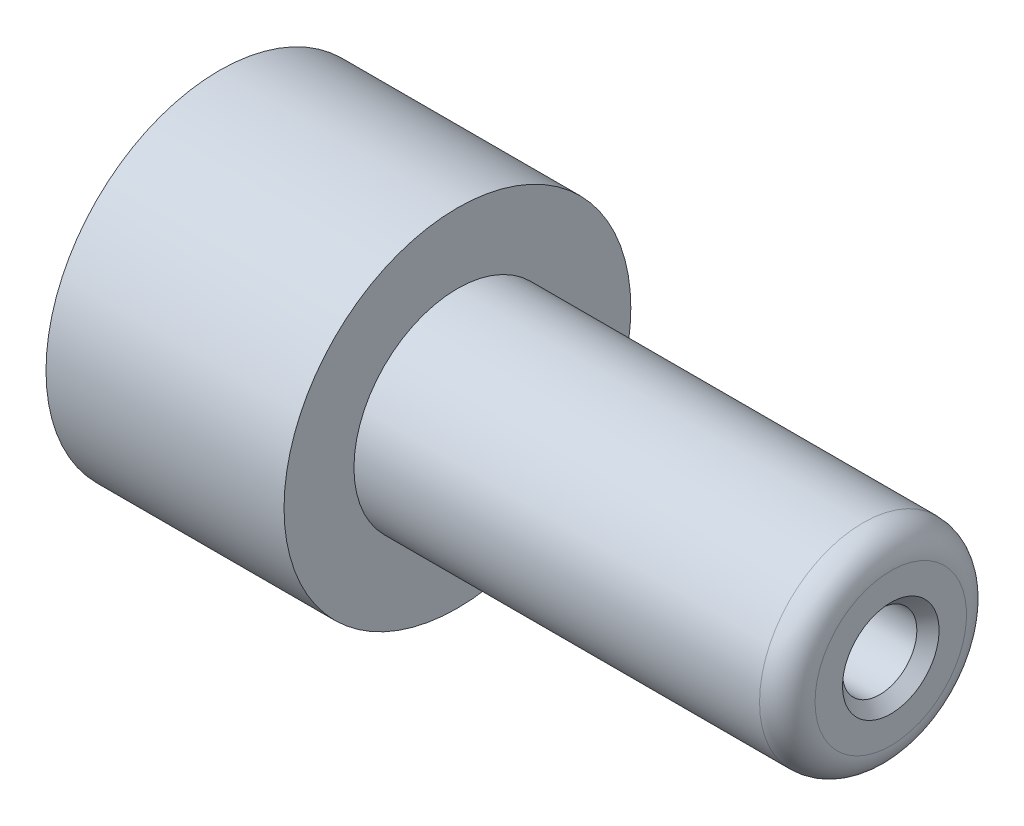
SolidWorks part; units mm, degrees
ref_plane "Front Plane" through (0, 0, 0) normal (0, 0, 1) x (1, 0, 0)
ref_plane "Top Plane" through (0, 0, 0) normal (0, 1, 0) x (1, 0, 0)
ref_plane "Right Plane" through (0, 0, 0) normal (1, 0, 0) x (0, 0, -1)
sketch "Sketch1" plane through (0, 0, 0) normal (0, 0, 1) x (1, 0, 0)
  line L0 (0, 0) -> (102.3864, 0) construction
  line L1 (0, 3.5687) -> (0, 7.9375)
  line L2 (0, 7.9375) -> (10.8966, 7.9375)
  line L3 (10.8966, 7.9375) -> (10.8966, 4.7371)
  line L4 (10.8966, 4.7371) -> (29.464, 4.7371)
  line L5 (30.734, 3.4671) -> (30.734, 0)
  line L6 (30.734, 0) -> (24.4856, 0)
  line L7 (0, 3.5687) -> (24.4856, 3.5687)
  line L8 (24.4856, 3.5687) -> (24.4856, 0)
  arc A0 (30.734, 3.4671) -> (29.464, 4.7371) centre (29.464, 3.4671) ccw
  dimension "D5" = 1.27
  dimension "D1" = 10.8966
  dimension "D2" = 15.875
  dimension "D3" = 24.4856
  dimension "D4" = 7.1374
  dimension "D6" = 30.734
  dimension "D7" = 9.4742
revolve "Revolve1" add sketch "Sketch1" angle 360 about L0
sketch "Sketch2" plane through (0, 0, 0) normal (-1, 0, 0) x (0, 0, 1)
  line L0 (0, 0) -> (0, 9.7644) construction
  circle A0 centre (-5.5499, 0) radius 1.1811
  circle A1 centre (5.5499, 0) radius 1.1811
  dimension "D2" = 2.3622
  dimension "D1" = 11.0998
extrude "Cut-Extrude1" cut sketch "Sketch2" against normal blind 2.3622
sketch "Sketch3" plane through (30.734, 0, 0) normal (1, 0, 0) x (0, 0, -1)
  circle A0 centre (0, 0) radius 1.7018
  dimension "D1" = 3.4036
extrude "Cut-Extrude2" cut sketch "Sketch3" against normal through all
chamfer "Chamfer1" distance 0.508 angle 45 1 edges at (30.734, 0, -1.7018)
